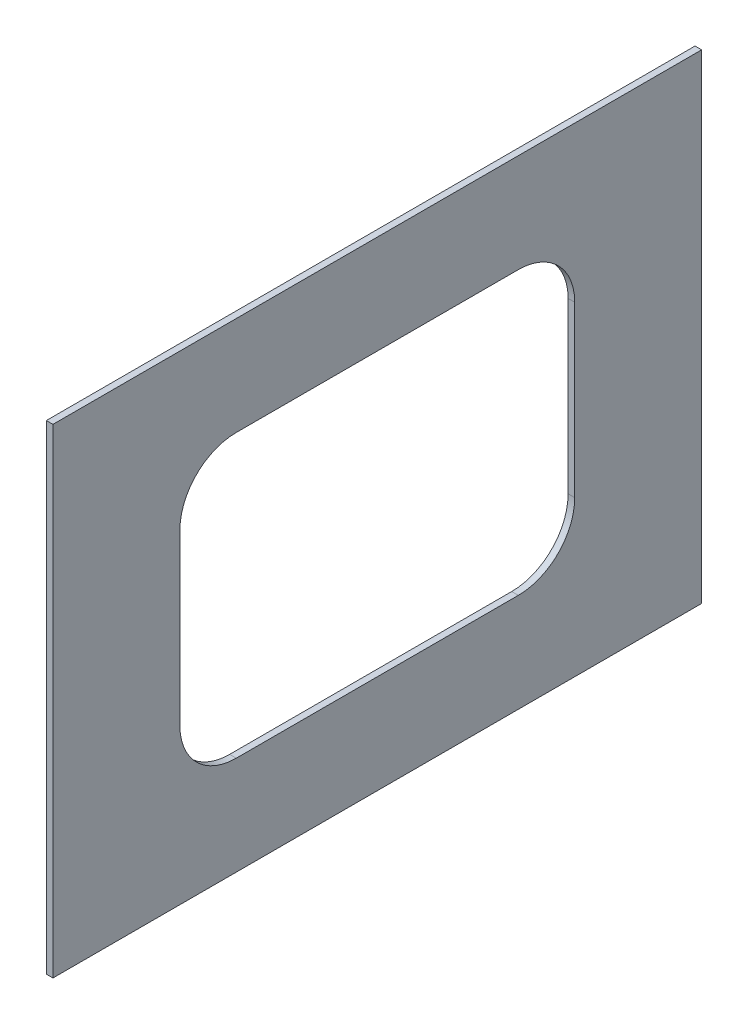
SolidWorks part; units mm, degrees
ref_plane "Front Plane" through (0, 0, 0) normal (0, 0, 1) x (1, 0, 0)
ref_plane "Top Plane" through (0, 0, 0) normal (0, 1, 0) x (1, 0, 0)
ref_plane "Right Plane" through (0, 0, 0) normal (1, 0, 0) x (0, 0, -1)
sketch "Sketch1" plane through (0, 0, 0) normal (1, 0, 0) x (0, 0, -1)
  line L0 (228.6, 279.4) -> (0, 279.4) construction
  line L1 (0, 0) -> (1168.4, 0)
  line L2 (0, 0) -> (0, 863.6)
  line L3 (0, 863.6) -> (1168.4, 863.6)
  line L4 (1168.4, 0) -> (1168.4, 863.6)
  line L5 (330.2, 685.8) -> (838.2, 685.8)
  line L6 (228.6, 584.2) -> (228.6, 279.4)
  line L7 (330.2, 177.8) -> (838.2, 177.8)
  line L8 (939.8, 584.2) -> (939.8, 279.4)
  line L9 (939.8, 279.4) -> (1168.4, 279.4) construction
  arc A4 (228.6, 279.4) -> (330.2, 177.8) centre (330.2, 279.4) ccw
  arc A5 (838.2, 177.8) -> (939.8, 279.4) centre (838.2, 279.4) ccw
  arc A6 (838.2, 685.8) -> (939.8, 584.2) centre (838.2, 584.2) cw
  arc A7 (330.2, 685.8) -> (228.6, 584.2) centre (330.2, 584.2) ccw
  point P24 (228.6, 177.8)
  point P27 (939.8, 177.8)
  point P30 (939.8, 685.8)
  dimension "D12" = 101.6
  dimension "D1" = 863.6
  dimension "D2" = 1168.4
  dimension "D3" = 177.8
  dimension "D4" = 711.2
  dimension "D5" = 508
extrude "Boss-Extrude1" add sketch "Sketch1" along normal blind 11.9062
